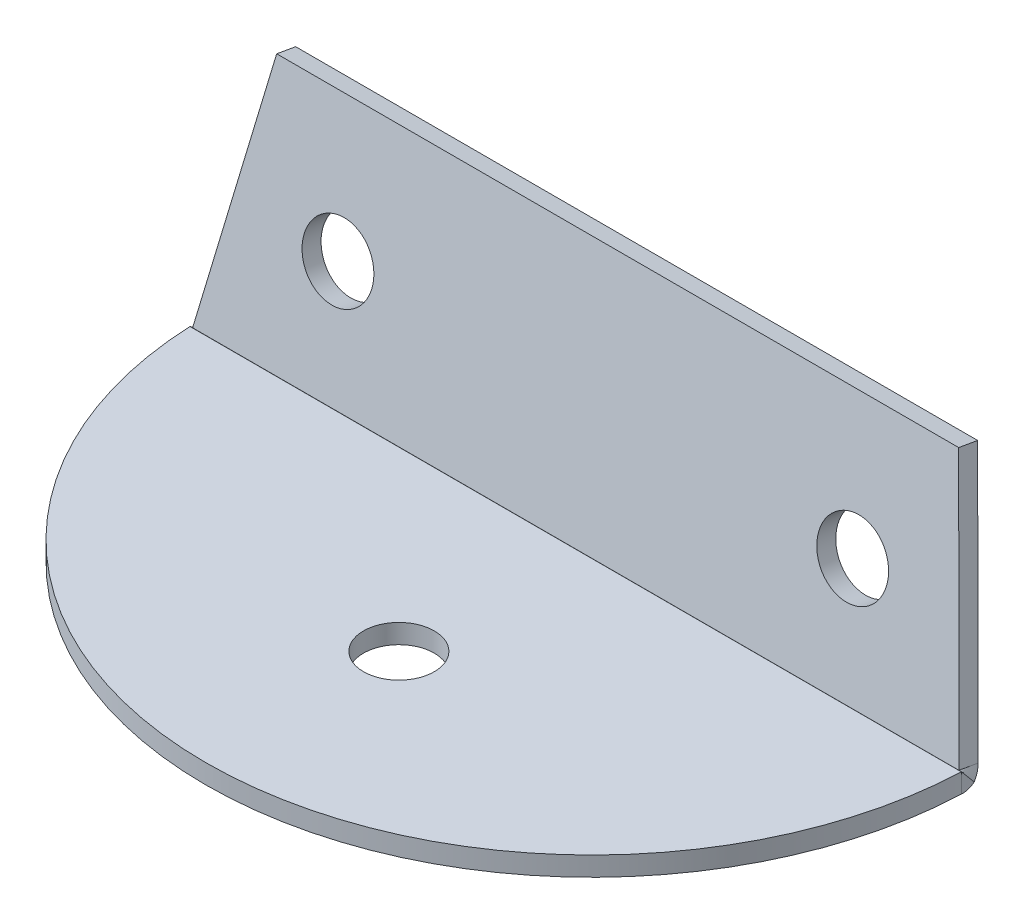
SolidWorks part; units mm, degrees
ref_plane "Front" through (0, 0, 0) normal (0, 0, 1) x (1, 0, 0)
ref_plane "Top" through (0, 0, 0) normal (0, 1, 0) x (1, 0, 0)
ref_plane "Right" through (0, 0, 0) normal (1, 0, 0) x (0, 0, -1)
sketch "Sketch1" plane through (0, 0, 0) normal (0, 1, 0) x (1, 0, 0)
  line L1 (3.5, 20) -> (56.5, 20)
  line L5 (3.5, 20) -> (0, 0)
  line L6 (56.5, 20) -> (60, 0)
  arc A0 (0, 0) -> (60, 0) centre (30, 0) ccw
  circle A1 centre (10, 10) radius 2.75
  circle A2 centre (50, 10) radius 2.75
  circle A3 centre (30, -15) radius 2.75
sheet metal parameters "Sheet-Metal1" thickness 1.5 parameters "D1"=0
base flange "Base-Flange1" sketch "Sketch1" thickness 1.5 reverse thickness direction yes parameters "D1"=0
sketch "Sketch3" plane through (0, 1.5, 0) normal (0, 1, 0) x (-1, 0, 0)
  line L0 (0, 0) -> (-60, 0)
sketched bend "Sketched Bend2" parameters "D1"=0.01
bend "SketchBend2" bend radius 0.01 bend angle 80 parameters "D5"=1
flat pattern "Flat-Pattern1"
sketch "Bend-Lines1" plane through (0, 0, 0) normal (0, 1, 0) x (-1, 0, 0)
bend of the flat pattern "Flatten-<SketchBend2>1"
